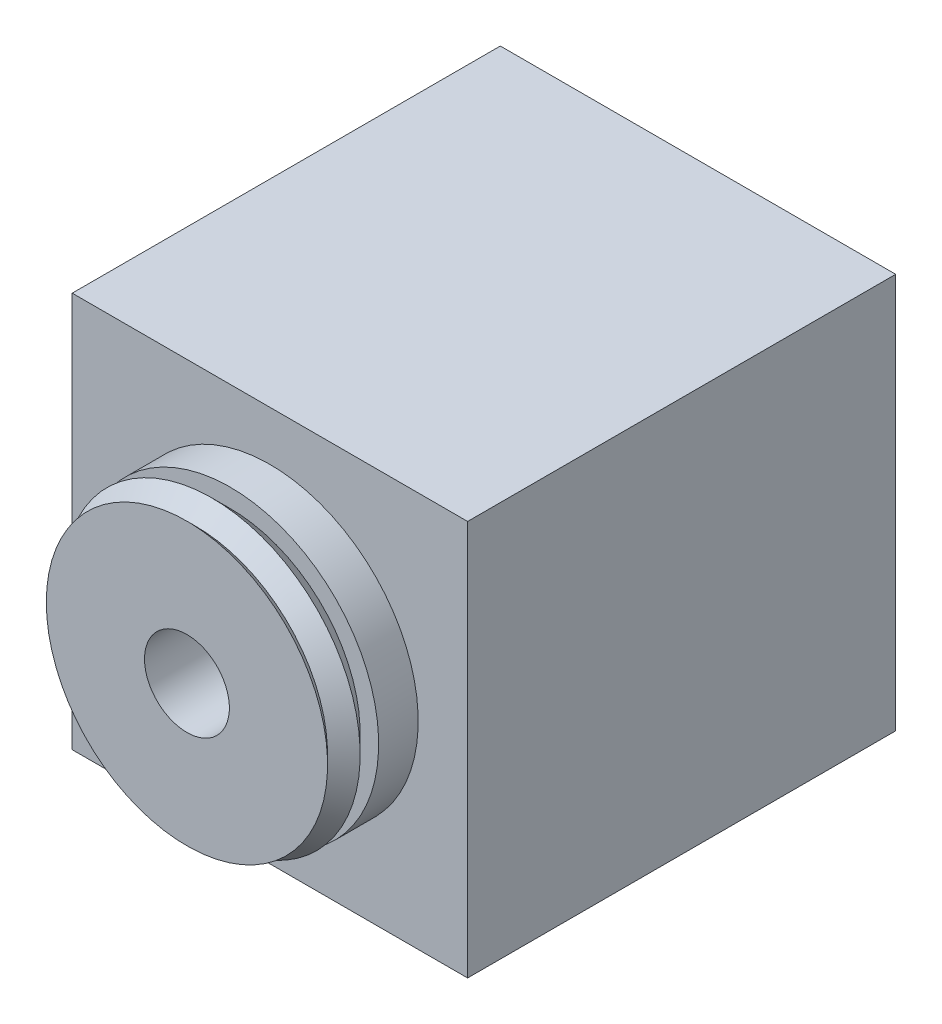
SolidWorks part; units mm, degrees
ref_plane "Front" through (0, 0, 0) normal (0, 0, 1) x (1, 0, 0)
ref_plane "Top" through (0, 0, 0) normal (0, 1, 0) x (1, 0, 0)
ref_plane "Right" through (0, 0, 0) normal (1, 0, 0) x (0, 0, -1)
ref_plane "Body Plane" through (0, 0, -3.9982) normal (0, 0, 1) x (1, 0, 0)
sketch "Sketch1" plane through (0, 0, 0) normal (1, 0, 0) x (0, 0, -1)
  line L0 (71.2941, 0) -> (-67.6458, 0) construction
  line L1 (0, 0) -> (0, 6.7754)
  line L2 (0, 6.7754) -> (0.4166, 6.3589)
  line L3 (0.4166, 6.3589) -> (1.2014, 7.1437)
  line L4 (1.2014, 7.1437) -> (2.0932, 6.252)
  line L5 (2.0932, 6.252) -> (2.0932, 7.1437)
  line L6 (2.0932, 7.1437) -> (3.9982, 7.1437)
  line L7 (3.9982, 7.1437) -> (3.9982, 0)
  line L8 (3.9982, 0) -> (0, 0)
  dimension "D1" = 45
  dimension "D2" = 7.1437
  dimension "D3" = 7.1437
  dimension "D4" = 0.8918
  dimension "D5" = 1.2014
  dimension "D6" = 6.7754
  dimension "Front Length" = 1.905
revolve "Base" add sketch "Sketch1" angle 360 about L0
sketch "Sketch9" plane through (0, 0, -3.9982) normal (0, 0, -1) x (-1, 0, 0)
  line L1 (-9.525, 9.525) -> (9.525, 9.525)
  line L2 (-9.525, 9.525) -> (-9.525, -9.525)
  line L3 (-9.525, -9.525) -> (9.525, -9.525)
  line L4 (9.525, 9.525) -> (9.525, -9.525)
  point P4 (0, 9.525)
  point P5 (9.525, 0)
  dimension "D1" = 19.05
  dimension "D2" = 19.05
extrude "F Body" add sketch "Sketch9" along normal blind 20.6248
sketch "Sketch11" plane through (0, 0, -24.623) normal (0, 0, -1) x (-1, 0, 0)
  line L0 (-9.525, 9.525) -> (9.525, -9.525) construction
  circle A0 centre (6.9195, 6.5509) radius 1.7272
  circle A1 centre (-6.5509, -6.9195) radius 1.7272
  dimension "D1" = 3.4544
  dimension "D2" = 19.05
extrude "F Mounting Holes" cut sketch "Sketch11" against normal blind 7.9248
sketch "Sketch12" [suppressed] plane through (-9.525, 0, 0) normal (-1, 0, 0) x (0, 0, 1)
  line L0 (-71.2941, 0) -> (67.6458, 0) construction
  line L1 (-24.623, -9.525) -> (-24.623, 9.525) construction
  circle A0 centre (-7.1732, 0) radius 1.7272
  dimension "D2" = 3.4544
  dimension "D1" = 17.4498
extrude "FDR Port A1" [suppressed] cut sketch "Sketch12" against normal blind 4.7498
sketch "Sketch13" [suppressed] plane through (9.525, 0, 0) normal (1, 0, 0) x (0, 0, -1)
  line L0 (24.623, 9.525) -> (24.623, -9.525) construction
  circle A0 centre (7.1732, -5.5499) radius 1.7272
  circle A1 centre (18.273, 5.5499) radius 1.7272
  dimension "D1" = 3.4544
  dimension "D2" = 3.4544
  dimension "D3" = 6.35
  dimension "D4" = 17.4498
  dimension "D5" = 5.5499
  dimension "D6" = 5.5499
extrude "FDR Mounting Holes" [suppressed] cut sketch "Sketch13" against normal blind 4.7498
sketch "Sketch14" plane through (-9.525, 0, 0) normal (-1, 0, 0) x (0, 0, 1)
  line L0 (-24.623, -9.525) -> (-24.623, 9.525) construction
  circle A0 centre (-7.1732, 5.5499) radius 1.7272
  circle A1 centre (-18.273, -5.5499) radius 1.7272
  dimension "D1" = 3.4544
  dimension "D2" = 3.4544
  dimension "D3" = 6.35
  dimension "D4" = 11.0998
  dimension "D5" = 5.5499
  dimension "D6" = 5.5499
extrude "FSR Mounting Holes" cut sketch "Sketch14" against normal blind 4.7498
sketch "Sketch10" plane through (0, 0, -24.623) normal (0, 0, -1) x (-1, 0, 0)
  circle A0 centre (0, 0) radius 5.5562
  dimension "D1" = 11.1125
extrude "F Body 2" add sketch "Sketch10" along normal blind 1.5748
sketch "Sketch15" plane through (0, 0, -3.9982) normal (0, 0, 1) x (1, 0, 0)
  circle A0 centre (0, 0) radius 4.7625
  dimension "D1" = 9.525
extrude "Single Acting Stud" [suppressed] add sketch "Sketch15" against normal blind 7.9375
chamfer "Single Acting Stud Chamfer" [suppressed] distance 0.7937 angle 45
sketch "Sketch4" plane through (0, 0, -3.9982) normal (0, 0, 1) x (1, 0, 0)
  circle A0 centre (0, 0) radius 8.7376
  dimension "D1" = 17.4752
extrude "Double Acting Stud Body" [suppressed] add sketch "Sketch4" against normal blind 12.7
sketch "Sketch5" [suppressed] plane through (0, 0, -16.6982) normal (0, 0, -1) x (-1, 0, 0)
  circle A0 centre (0, 0) radius 5.5562
  dimension "D1" = 11.1125
extrude "Double Acting Stud Body 2" [suppressed] add sketch "Sketch5" along normal blind 9.525
chamfer "Double Acting Stud Chamfer" [suppressed] distance 0.7937 angle 45
sketch "Sketch8" [suppressed] plane through (0, 0, 0) normal (1, 0, 0) x (0, 0, -1)
  line L0 (15.9045, 0) -> (3.9982, 0) construction
  line L1 (3.9982, 8.7376) -> (3.9982, -8.7376) construction
  circle A0 centre (7.1732, 0) radius 2.032
  dimension "D1" = 4.064
  dimension "D2" = 3.175
extrude "Double Acting Stud Port A1" [suppressed] cut sketch "Sketch8" against normal through all
sketch "Sketch16" [suppressed] plane through (0, 0, 0) normal (0, 1, 0) x (1, 0, 0)
  line L2 (-8.7376, 3.9982) -> (8.7376, 3.9982) construction
  circle A0 centre (0, 7.1732) radius 2.032
  dimension "D1" = 4.064
  dimension "D2" = 3.175
extrude "Double Acting Stud Port A2" [suppressed] cut sketch "Sketch16" along normal through all
sketch "Sketch3" plane through (0, 0, 0) normal (0, 0, -1) x (-1, 0, 0)
  circle A0 centre (0, 0) radius 2.0447
  dimension "D1" = 4.0894
extrude "Hole Cut" cut sketch "Sketch3" along normal through all
